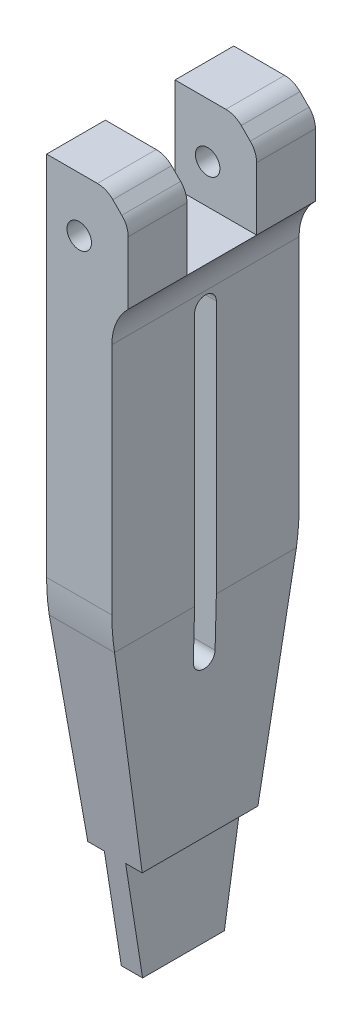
SolidWorks part; units mm, degrees
ref_plane "Front Plane" through (0, 0, 0) normal (0, 0, 1) x (1, 0, 0)
ref_plane "Top Plane" through (0, 0, 0) normal (0, 1, 0) x (1, 0, 0)
ref_plane "Right Plane" through (0, 0, 0) normal (1, 0, 0) x (0, 0, -1)
sketch "Sketch2" plane through (0, 0, 0) normal (0, 0, 1) x (1, 0, 0)
  line L0 (-3, 28.75) -> (-3, 33.75) construction
  line L1 (3, -28.75) -> (-3, -28.75) construction
  line L2 (3, -28.75) -> (3, 28.75) construction
  line L3 (3, 28.75) -> (-3, 28.75) construction
  line L4 (-3, -28.75) -> (-3, 28.75) construction
  line L5 (3, -28.75) -> (-3, 28.75) construction
  line L6 (3, 28.75) -> (-3, -28.75) construction
  line L7 (-3, 33.75) -> (3, 33.75) construction
  line L8 (3, 33.75) -> (3, 28.75) construction
  line L9 (-3, 33.75) -> (-3, 28.75)
  line L10 (-3, 28.75) -> (-3, -28.75)
  line L11 (-3, -28.75) -> (3, -28.75)
  line L12 (3, -28.75) -> (3, 28.75)
  line L13 (3, 28.75) -> (3, 33.75)
  line L14 (3, 33.75) -> (-3, 33.75)
  point P0 (0, 0)
  dimension "D1" = 57.5
  dimension "D2" = 6
  dimension "D3" = 5
extrude "Boss-Extrude1" add sketch "Sketch2" along normal blind 17.2
sketch "Sketch3" plane through (3, 0, 0) normal (1, 0, 0) x (0, 0, -1)
  line L0 (-8.6, 33.75) -> (-8.6, 26.75) construction
  line L2 (-17.2, 33.75) -> (0, 33.75) construction
  line L3 (-17.2, 33.75) -> (-11.8, 33.75) construction
  line L4 (-11.8, 33.75) -> (-11.8, 26.65) construction
  line L7 (-5.4, 33.75) -> (-5.4, 26.65) construction
  line L8 (-11.8, 33.75) -> (-5.4, 33.75)
  line L9 (-5.4, 33.75) -> (-5.4, 26.65)
  line L10 (-5.4, 26.65) -> (-11.8, 26.65)
  line L11 (-11.8, 26.65) -> (-11.8, 33.75)
  dimension "D1" = 7
  dimension "D2" = 5.4
  dimension "D3" = 7.1
  dimension "D4" = 6.4
sketch "Sketch4" plane through (0, 0, 17.2) normal (0, 0, 1) x (1, 0, 0)
  line L0 (0, -28.75) -> (3, 2.5)
  line L1 (-3, -28.75) -> (3, -28.75) construction
  line L2 (3, -28.75) -> (3, 33.75) construction
  line L3 (3, 2.5) -> (3, -28.75)
  line L4 (3, -28.75) -> (0, -28.75)
sketch "Sketch5" plane through (3, 0, 0) normal (1, 0, 0) x (0, 0, -1)
  line L0 (-8.6, 33.75) -> (-8.6, 22.75) construction
  line L1 (-17.2, 33.75) -> (0, 33.75) construction
  line L3 (-9.6, 21.75) -> (-9.6, -6.0934)
  line L4 (-7.6, -6.0934) -> (-7.6, 21.75)
  line L5 (-8.6, -7.0934) -> (-8.6, -28.75) construction
  arc A0 (-7.6, 21.75) -> (-9.6, 21.75) centre (-8.6, 21.75) ccw
  arc A1 (-9.6, -6.0934) -> (-7.6, -6.0934) centre (-8.6, -6.0934) ccw
  dimension "D2" = 2
  dimension "D3" = 29.8434
  dimension "D1" = 12
extrude "Cut-Extrude4" cut sketch "Sketch5" against normal through all
sketch "Sketch17" plane through (0, 0, 0) normal (0, 0, -1) x (-1, 0, 0)
  line L1 (-3, -28.75) -> (-3, 33.75) construction
  line L2 (-3, 26.65) -> (-4.5, 26.65) construction
  line L3 (-4.5, 26.65) -> (-4.5, 33.75) construction
  line L5 (-4.5, 33.75) -> (-4.5, 35.25) construction
  line L7 (3, 33.75) -> (3, 35.25) construction
  line L8 (3, 35.25) -> (-4.5, 35.25) construction
  line L9 (-3, 26.65) -> (-4.5, 26.65)
  line L10 (-4.5, 26.65) -> (-4.5, 35.25)
  line L11 (-4.5, 35.25) -> (3, 35.25)
  line L12 (3, 35.25) -> (3, 33.75)
  line L13 (-3, 26.65) -> (-1.9863, 26.65)
  line L14 (-1.9863, 26.65) -> (-1.9863, 33.205)
  line L15 (-1.9863, 33.205) -> (3, 33.205)
  line L16 (3, 33.205) -> (3, 33.75)
  dimension "D2" = 1.5
  dimension "D3" = 1.5
sketch "Sketch7" plane through (0, 0, 0) normal (0, 0, -1) x (-1, 0, 0)
  line L0 (-3, 33.75) -> (3, 33.75) construction
  line L1 (0, 30.25) -> (3, 30.25) construction
  line L2 (3, 33.75) -> (3, -28.75) construction
  circle A0 centre (0, 30.25) radius 1.125
  point P2 (0, 33.75)
  dimension "D1" = 2.25
  dimension "D2" = 3.5
  dimension "D3" = 3
extrude "Cut-Extrude7" cut sketch "Sketch7" against normal through all
extrude "Cut-Extrude8" cut sketch "Sketch3" against normal through all
sketch "Sketch8" plane through (3, 0, 0) normal (1, 0, 0) x (0, 0, -1)
  line L0 (-8.6, 26.65) -> (-8.6, -22.8322) construction
  line L1 (-11.8, 26.65) -> (-5.4, 26.65) construction
  line L2 (-8.6, -29.205) -> (-4.6, -29.205) construction
  line L3 (0, 0) -> (-4.6, -29.205) construction
  line L4 (-4.6, -29.205) -> (-4.6, -29.9351)
  line L5 (-4.6, -29.9351) -> (4.8239, -29.9351)
  line L6 (4.8239, -29.9351) -> (4.8239, 0)
  line L7 (4.8239, 0) -> (0, 0)
  line L8 (0, 0) -> (-4.6, -29.205)
  line L9 (-12.6, -29.205) -> (-12.6, -29.9351)
  line L10 (-12.6, -29.9351) -> (-22.0239, -29.9351)
  line L11 (-22.0239, -29.9351) -> (-22.0239, 0)
  line L12 (-22.0239, 0) -> (-17.2, 0)
  line L13 (-17.2, 0) -> (-12.6, -29.205)
  dimension "D1" = 4
extrude "Cut-Extrude9" cut sketch "Sketch8" against normal through all
fillet "Fillet4" radius 20 1 edges at (0, 0, 0)
fillet "Fillet5" radius 20 1 edges at (0, 0, 17.2)
shell "Shell2" thickness 2
chamfer "Chamfer4" [suppressed] distance 0.25 angle 45
chamfer "Chamfer5" distance 0.25 angle 45 1 edges at (0, 33.75, 17.2)
sketch "Sketch9" [suppressed] plane through (0, -28.75, 0) normal (0, -1, 0) x (1, 0, 0)
  line L0 (-3, 12.6717) -> (-3, 4.5283) construction
  line L1 (-3, 4.5283) -> (3, 12.6717) construction
  line L2 (3, 16.7095) -> (3, 12.4186) construction
  line L3 (3, 12.6717) -> (-3, 12.6717) construction
  line L4 (-3, 12.6717) -> (3, 4.5283) construction
  line L5 (3, 4.7814) -> (3, 0.4905) construction
  line L6 (3, 4.5283) -> (3, 12.6717) construction
  line L9 (-1.5, 6.35) -> (1.5, 6.35)
  line L10 (-1.5, 6.35) -> (-1.5, 10.85)
  line L11 (-1.5, 10.85) -> (1.5, 10.85)
  line L12 (1.5, 6.35) -> (1.5, 10.85)
  line L13 (-1.5, 6.35) -> (1.5, 10.85) construction
  line L14 (-1.5, 10.85) -> (1.5, 6.35) construction
  point P4 (0, 8.6)
  dimension "D1" = 6
  dimension "D2" = 8.1433
  dimension "D3" = 3
  dimension "D4" = 4.5
extrude "Cut-Extrude10" [suppressed] cut sketch "Sketch9" against normal blind 9
fillet "Fillet6" [suppressed] radius 2
sketch "Sketch12" plane through (0, 0, 0) normal (0, -0.1556, -0.9878) x (-1, 0, 0)
  line L0 (-3, -21.1044) -> (3, -21.1044) construction
  line L1 (-3, -1.5654) -> (-3, -29.1044) construction
  line L2 (3, -1.5654) -> (3, -29.1044) construction
  line L3 (0, -21.1044) -> (-1.25, -21.1044) construction
  line L4 (3, -29.1044) -> (-3, -29.1044) construction
  line L5 (-1.25, -21.1044) -> (-2.5, -21.1044) construction
  line L6 (-3, -1.5654) -> (-2.5, -21.1044)
  line L7 (-2.5, -21.1044) -> (-1.25, -21.1044)
  line L8 (-1.25, -21.1044) -> (-1.25, -29.1044)
  line L9 (-1.25, -29.1044) -> (-3, -29.1044)
  line L10 (-3, -29.1044) -> (-3, -1.5654)
  line L11 (0, -21.1044) -> (-3, -21.1044) construction
  line L12 (0, -21.1044) -> (0, -29.1044) construction
  line L13 (1.25, -21.1044) -> (2.5, -21.1044) construction
  line L14 (3, -29.1044) -> (3, -1.5654)
  line L15 (1.25, -29.1044) -> (3, -29.1044)
  line L16 (1.25, -21.1044) -> (1.25, -29.1044)
  line L17 (2.5, -21.1044) -> (1.25, -21.1044)
  line L18 (3, -1.5654) -> (2.5, -21.1044)
  dimension "D1" = 6
  dimension "D2" = 1.25
  dimension "D3" = 8
  dimension "D4" = 1.25
  dimension "D5" = 3
sketch "Sketch13" plane through (0, 0, 0) normal (0, 0, 1) x (1, 0, 0)
  line L0 (3, -1.5464) -> (3, -20.8474)
  line L1 (3, -20.8474) -> (3, -28.75)
  line L2 (3, -28.75) -> (1.25, -28.75)
  line L3 (-0.9782, -20.8474) -> (-1.25, -20.8474)
  line L4 (1.25, -20.8474) -> (2.5, -20.8474)
  line L5 (2.5, -20.8474) -> (3, -1.5464)
  line L7 (-2.5, -20.8474) -> (-3, -1.5464)
  line L8 (-1.25, -20.8474) -> (-2.5, -20.8474)
  line L9 (-0.9782, -28.75) -> (-1.25, -28.75)
  line L10 (-3, -28.75) -> (-1.25, -28.75)
  line L11 (-3, -20.8474) -> (-3, -28.75)
  line L12 (-3, -1.5464) -> (-3, -20.8474)
  line L13 (1.25, -20.8474) -> (0.9782, -20.8474)
  line L15 (0.9782, -20.8474) -> (0.9782, -28.75)
  line L17 (0.9782, -28.75) -> (1.25, -28.75)
  line L18 (0.9782, -20.8474) -> (1.25, -20.8474)
  line L19 (-0.9782, -28.75) -> (-1.25, -28.75)
  line L20 (-0.9782, -20.8474) -> (-0.9782, -28.75)
  line L21 (-1.25, -20.8474) -> (-0.9782, -20.8474)
  line L22 (0.9782, -28.75) -> (1.25, -28.75)
  line L23 (-0.9782, -28.75) -> (-1.25, -28.75)
extrude "Cut-Extrude13" cut sketch "Sketch13" along normal through all contours L15 L17 L2 L1 L0 L5 L4 L13 | L20 L3 L8 L7 L12 L11 L10 L9
sketch "Sketch14" plane through (0.9782, 0, 0) normal (1, 0, 0) x (0, 0, -1)
  line L0 (-11.8917, -20.8474) -> (-10.962, -26.75)
  line L1 (-10.962, -26.75) -> (-6.238, -26.75)
  line L2 (-6.238, -26.75) -> (-5.3083, -20.8474)
  line L3 (-5.3083, -20.8474) -> (-11.8917, -20.8474)
  line L4 (-5.3083, -20.8474) -> (-4.2192, -13.9327)
  line L6 (-11.8917, -20.8474) -> (-12.8252, -13.9327)
  line L7 (-12.8252, -13.9327) -> (-4.2192, -13.9327)
  dimension "D1" = 7
extrude "Boss-Extrude4" add sketch "Sketch14" against normal up to surface (1.9564 mm away) contours L3 M3 M5 M4
sketch "Sketch15" plane through (1, 0, 0) normal (-1, 0, 0) x (0, 0, 1)
  line L0 (12.9808, -13.9327) -> (4.2192, -13.9327)
  line L1 (11.8917, -20.8474) -> (14.9808, -1.2352) construction
  line L2 (11.8917, -20.8474) -> (5.3083, -20.8474)
  line L3 (5.3083, -20.8474) -> (4.2192, -13.9327)
  line L4 (12.9808, -13.9327) -> (11.8917, -20.8474)
extrude "Boss-Extrude7" add sketch "Sketch15" along normal up to surface (3.5 mm away)
extrude "Boss-Extrude10" add sketch "Sketch17" against normal up to surface (17.2 mm away)
sketch "Sketch18" plane through (4.5, 0, 0) normal (1, 0, 0) x (0, 0, -1)
  line L0 (-11.8, 26.65) -> (-5.4, 26.65)
  line L1 (-5.4, 26.65) -> (-5.4, 35.25)
  line L2 (-17.2, 35.25) -> (0, 35.25) construction
  line L3 (-5.4, 35.25) -> (-11.8, 35.25)
  line L4 (-11.8, 35.25) -> (-11.8, 26.65)
extrude "Cut-Extrude14" cut sketch "Sketch18" against normal blind 10
fillet "Fillet7" radius 5 2 edges at (3, 26.65, 14.5) (3, 26.65, 2.7)
chamfer "Chamfer6" distance 2 angle 45 2 edges at (4.5, 35.25, 2.7) (4.5, 35.25, 14.5)
fillet "Fillet8" radius 2 4 edges at (4.5, 33.25, 2.7) (2.5, 35.25, 2.7) (4.5, 33.25, 14.5) (2.5, 35.25, 14.5)
sketch "Sketch19" plane through (0, 0, 0) normal (0, 0, -1) x (-1, 0, 0)
  line L0 (-4.5, 26.65) -> (-3, 26.65)
  line L1 (-3, 26.65) -> (-3, 33.75) construction
  line L2 (-3, 33.75) -> (-3, 26.65) construction
  line L3 (-3, 26.65) -> (-3, 23.0793)
  arc A0 (-4.5, 26.65) -> (-3, 23.0793) centre (-8, 23.0793) cw
extrude "Boss-Extrude11" add sketch "Sketch19" against normal up to surface (17.2 mm away)
sketch "Sketch20" plane through (3, 0, 0) normal (1, 0, 0) x (0, 0, -1)
  line L0 (-17.2, 35.25) -> (-11.8, 35.25) construction
  line L1 (-12.6717, -28.75) -> (-4.5283, -28.75) construction
  line L2 (-17.2, 32.4216) -> (-17.2, 26.65) construction
  line L3 (0, 32.4216) -> (0, 26.65) construction
  line L4 (-5.4, 26.65) -> (-5.4, 32.4216) construction
  line L5 (-11.8, 32.4216) -> (-11.8, 26.65) construction
  line L6 (-5.4, 35.25) -> (0, 35.25) construction
  line L7 (-11.8, 26.65) -> (-5.4, 26.65) construction
  line L8 (0, 23.0793) -> (-17.2, 23.0793) construction
  line L9 (-5.4, 26.65) -> (0, 26.65) construction
  line L10 (-7.6, -1.5464) -> (-0.2436, -1.5464) construction
  line L11 (-13.9164, -20.8474) -> (-3.2836, -20.8474) construction
  line L13 (-8.6, -7.0934) -> (-8.6, 22.75) construction
  line L14 (-9.6, 21.75) -> (-9.6, -1.5464) construction
  line L15 (-7.6, -1.5464) -> (-7.6, 21.75) construction
  line L16 (-17.139, 0.0048) -> (-12.6717, -28.75) construction
  line L17 (-12.6717, -28.75) -> (-17.139, -28.75) construction
  line L18 (-17.139, -28.75) -> (-17.139, 0.0048) construction
  arc A2 (-9.6, -6.0934) -> (-7.6, -6.0934) centre (-8.6, -6.0934) ccw construction
  arc A3 (-7.6, 21.75) -> (-9.6, 21.75) centre (-8.6, 21.75) ccw construction
  arc A4 (-17.2, 1.5654) -> (-16.9564, -1.5464) centre (2.8, 1.5654) ccw construction
  point P2 (-14.5, 35.25)
  point P5 (-8.6, -28.75)
  point P8 (-17.2, 29.5358)
  point P11 (0, 29.5358)
  point P17 (-11.8, 29.5358)
  point P18 (-5.4, 29.5358)
  point P21 (-2.7, 35.25)
  point P24 (-8.6, 26.65)
  point P29 (-2.7, 26.65)
  point P34 (-8.6, -20.8474)
  point P35 (-3.9218, -1.5464)
  dimension "D11" = 29.8434
  dimension "D1" = 64
  dimension "D2" = 17.2
  dimension "D3" = 5.4
  dimension "D4" = 6.4
  dimension "D5" = 5.4
  dimension "D6" = 8.6
  dimension "D7" = 3.5707
  dimension "D8" = 24.6256
  dimension "D9" = 19.3011
  dimension "D10" = 7.9026
  dimension "D12" = 2
  dimension "D13" = 8.831
sketch "Sketch22" plane through (0, 0, 0) normal (0, 0, -1) x (-1, 0, 0)
  line L0 (3, 35.25) -> (-1.6716, 35.25) construction
  line L1 (0.9782, -28.75) -> (-0.9782, -28.75) construction
  line L2 (2.5, -20.8474) -> (0.9782, -20.8474) construction
  line L3 (-0.9782, -28.75) -> (-0.9782, -20.8474) construction
  line L4 (0.9782, -28.75) -> (0.9782, -20.8474) construction
  line L5 (-4.5, 32.4216) -> (-4.5, 26.65) construction
  line L6 (3, 35.25) -> (3, 1.5654) construction
  line L7 (-3, 1.5654) -> (3, 1.5654) construction
  line L8 (-4.5, 26.65) -> (-3, 26.65) construction
  line L9 (-3, 26.65) -> (-3, 23.0793) construction
  line L10 (3, -1.5464) -> (-3, -1.5464) construction
  circle A0 centre (0, 30.25) radius 1.125
  point P2 (0.6642, 35.25)
  point P5 (0, -28.75)
  point P8 (1.7391, -20.8474)
  point P12 (-0.9782, -24.7987)
  point P15 (0.9782, -24.7987)
  point P19 (-4.5, 29.5358)
  point P32 (0, 1.5654)
  point P35 (0, -1.5464)
  dimension "D8" = 1.5
  dimension "D10" = 2.25
  dimension "D1" = 64
  dimension "D2" = 7.9026
  dimension "D3" = 1.5218
  dimension "D4" = 1.5218
  dimension "D5" = 1.9564
  dimension "D6" = 56.0974
  dimension "D7" = 7.5
  dimension "D9" = 3.5707
  dimension "D11" = 33.6846
  dimension "D12" = 3.1118
sketch "Sketch24" plane through (0.9782, 0, 0) normal (1, 0, 0) x (0, 0, -1)
  line L0 (-12.6717, -28.75) -> (-12.9554, -26.9484)
  line L1 (-13.9164, -20.8474) -> (-12.6717, -28.75) construction
  line L2 (-12.6717, -28.75) -> (-4.5283, -28.75)
  line L3 (-8.6, -28.75) -> (-8.6, -30.75)
  line L4 (-12.6717, -28.75) -> (-12.3566, -30.75)
  line L5 (-12.3566, -30.75) -> (-4.8434, -30.75)
  line L6 (-4.5283, -28.75) -> (-4.8434, -30.75)
  dimension "D1" = 2
extrude "Boss-Extrude12" add sketch "Sketch24" against normal up to surface (1.9564 mm away) contours L6 L2 L3 L5 | L4 L5 L3 M8
